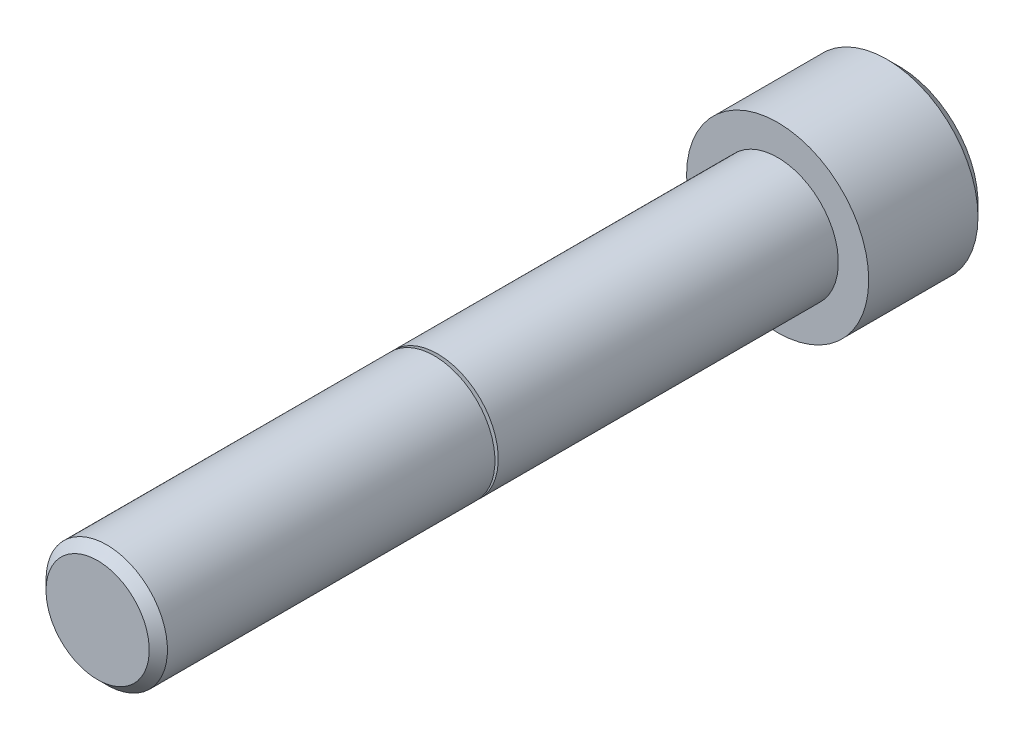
SolidWorks part; units mm, degrees
ref_plane "Front" through (0, 0, 0) normal (0, 0, 1) x (1, 0, 0)
ref_plane "Top" through (0, 0, 0) normal (0, 1, 0) x (1, 0, 0)
ref_plane "Right" through (0, 0, 0) normal (1, 0, 0) x (0, 0, -1)
sketch "Logo3_Revol_Axis" plane through (0, 0, 0) normal (0, 1, 0) x (1, 0, 0)
  line L0 (0, -43.5172) -> (0, 43.5172) construction
sketch "Logo3_bib1" plane through (0, 0, 0) normal (0, -1, 0) x (-1, 0, 0)
  line L0 (0, -88.9) -> (0, 15.875)
  line L1 (0, 15.875) -> (10.3188, 15.875)
  line L2 (11.9062, 14.2875) -> (11.9063, 0)
  line L3 (11.9063, 0) -> (7.9375, 0)
  line L4 (7.9375, 0) -> (7.9375, -44.46)
  line L5 (7.9375, -87.71) -> (6.7475, -88.9)
  line L6 (6.7475, -88.9) -> (0, -88.9)
  line L7 (7.9375, -44.46) -> (6.8609, -44.46)
  line L8 (6.8541, -44.4988) -> (7.9375, -44.8931)
  line L9 (7.9375, -44.8931) -> (7.9375, -87.71)
  line L10 (0, 10.5852) -> (0, -63.2873) construction
  line L11 (10.3188, 15.875) -> (11.9062, 14.2875)
  arc A1 (6.8609, -44.46) -> (6.8541, -44.4988) centre (6.8609, -44.48) ccw
  point P17 (6.7475, -44.46)
  point P19 (11.9062, 15.875)
revolve "Revolve1" add sketch "Logo3_bib1" angle 360 about L10
sketch "Logo3_bib2" plane through (0, 0, -15.875) normal (0, 0, -1) x (1, 0, 0)
  line L1 (7.3323, 0) -> (3.6662, 6.35)
  line L2 (3.6662, 6.35) -> (-3.6662, 6.35)
  line L3 (-3.6662, 6.35) -> (-7.3323, 0)
  line L4 (-7.3323, 0) -> (-3.6662, -6.35)
  line L5 (-3.6662, -6.35) -> (3.6662, -6.35)
  line L6 (3.6662, -6.35) -> (7.3323, 0)
  circle A0 centre (0, 0) radius 6.35 construction
  dimension "Logo3_c1" = 12.7
extrude "Cut-Extrude1" cut sketch "Logo3_bib2" against normal blind 7.9375
equation "\"DIA2@Logo3_bib1\" = \"Logo3_d1-pas@Logo3_bib1\""
equation "\"LGT1@Logo3_bib1\" = \"Logo3_d1@Logo3_bib1\""
equation "\"D1@Cut-Extrude1\" = \"Logo3_d1@Logo3_bib1\"/2."
equation "\"D2@Cosmetic Thread1\" = \"Logo3_d1-pas@Logo3_bib1\""
equation "\"D5@Logo3_bib1\"=\"Logo3_d1@Logo3_bib1\"*.1"
